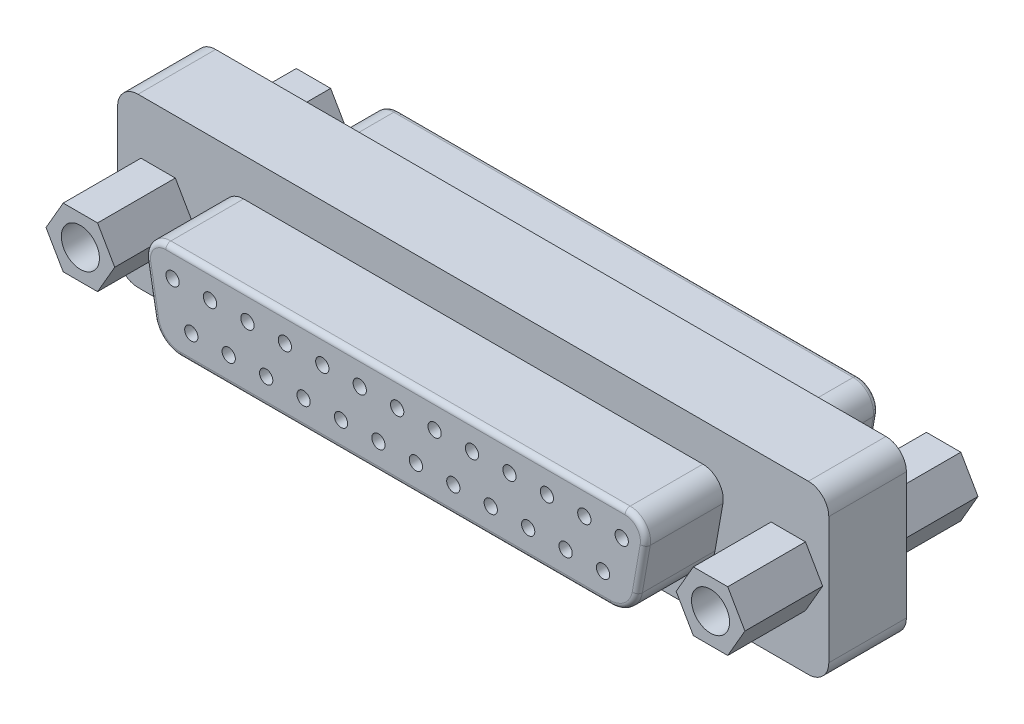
SolidWorks part; units mm, degrees
ref_plane "Plane1" through (0, 0, 0) normal (0, 0, 1) x (1, 0, 0)
ref_plane "Plane2" through (0, 0, 0) normal (0, 1, 0) x (1, 0, 0)
ref_plane "Plane3" through (0, 0, 0) normal (1, 0, 0) x (0, 0, -1)
sketch "Sketch1" plane through (0, 0, 0) normal (0, 0, 1) x (1, 0, 0)
  line L0 (25.019, 4.7244) -> (-25.019, -4.7244) construction
  line L1 (-25.019, 6.2484) -> (25.019, 6.2484)
  line L2 (-26.543, 4.7244) -> (-26.543, -4.7244)
  line L3 (-25.019, -6.2484) -> (25.019, -6.2484)
  line L4 (26.543, 4.7244) -> (26.543, -4.7244)
  line L5 (0, 0) -> (0, 7.4679) construction
  arc A0 (25.019, 6.2484) -> (26.543, 4.7244) centre (25.019, 4.7244) cw
  arc A1 (25.019, -6.2484) -> (26.543, -4.7244) centre (25.019, -4.7244) ccw
  arc A2 (-26.543, -4.7244) -> (-25.019, -6.2484) centre (-25.019, -4.7244) ccw
  arc A3 (-25.019, 6.2484) -> (-26.543, 4.7244) centre (-25.019, 4.7244) ccw
  circle A4 centre (-23.5204, 0) radius 1.524 construction
  circle A5 centre (23.5204, 0) radius 1.524 construction
  point P9 (26.543, -6.2484)
  point P15 (-26.543, 6.2484)
  dimension "D1" = 1.524
  dimension "mounting_holes_diameter" = 3.048
  dimension "flange_length" = 53.086
  dimension "flange_width" = 12.4968
  dimension "mounting_hole_pitch" = 47.0408
extrude "Flange Base-Extrude" add sketch "Sketch1" along normal mid plane 5.7912
sketch "Sketch2" plane through (0, 0, 0) normal (0, 0, 1) x (1, 0, 0)
  line L0 (-18.6436, 1.6277) -> (-18.0503, -1.7372)
  line L1 (18.6436, 1.6277) -> (18.0503, -1.7372)
  line L2 (16.0492, -3.4163) -> (-16.0492, -3.4163)
  line L3 (-17.1428, 3.4163) -> (17.1428, 3.4163)
  line L4 (0, 0) -> (0, 5.2616) construction
  line L5 (0, 0) -> (3.5249, 0) construction
  arc A0 (18.6436, 1.6277) -> (17.1428, 3.4163) centre (17.1428, 1.8923) ccw
  arc A1 (-18.6436, 1.6277) -> (-17.1428, 3.4163) centre (-17.1428, 1.8923) cw
  arc A2 (18.0503, -1.7372) -> (16.0492, -3.4163) centre (16.0492, -1.3843) cw
  arc A3 (-18.0503, -1.7372) -> (-16.0492, -3.4163) centre (-16.0492, -1.3843) ccw
  dimension "D2" = 1.524
  dimension "D3" = 2.032
  dimension "D1" = 20
  dimension "guard_width" = 6.8326
  dimension "guard_length" = 37.2872
extrude "Extrude3" add sketch "Sketch2" along normal blind 8.6995
sketch "Sketch5" plane through (0, 0, 2.8956) normal (0, 0, 1) x (1, 0, 0)
  line L0 (0, 0) -> (0, 25.4) construction
  line L1 (-26.0867, 0) -> (-24.8036, -2.2225)
  line L2 (-24.8036, -2.2225) -> (-22.2372, -2.2225)
  line L3 (-22.2372, -2.2225) -> (-20.9541, 0)
  line L4 (-20.9541, 0) -> (-22.2372, 2.2225)
  line L5 (-22.2372, 2.2225) -> (-24.8036, 2.2225)
  line L6 (-24.8036, 2.2225) -> (-26.0867, 0)
  line L7 (24.8036, 2.2225) -> (26.0867, 0)
  line L8 (22.2372, 2.2225) -> (24.8036, 2.2225)
  line L9 (20.9541, 0) -> (22.2372, 2.2225)
  line L10 (22.2372, -2.2225) -> (20.9541, 0)
  line L11 (24.8036, -2.2225) -> (22.2372, -2.2225)
  line L12 (26.0867, 0) -> (24.8036, -2.2225)
  circle A0 centre (-23.5204, 0) radius 2.2225 construction
  circle A1 centre (-23.5204, 0) radius 1.524 construction
  circle A2 centre (23.5204, 0) radius 2.2225 construction
  dimension "D1" = 4.445
extrude "Extrude4" add sketch "Sketch5" along normal up to surface (5.8039 mm away)
hole_wizard "#4-40 Tapped Hole1" positions "Sketch7" profile "Sketch6" tap size "#4-40" standard "STS Hardware Standard"
sketch "Sketch7" plane through (0, 0, 8.6995) normal (0, 0, 1) x (1, 0, 0)
  point P0 (-23.5204, 0)
  point P2 (23.5204, 0)
sketch "Sketch6" plane through (-23.5204, 0, 8.6995) normal (1, 0, 0) x (0, -1, 0)
  line L0 (0, 0) -> (0, 8.2738)
  line L1 (0, 8.2738) -> (1.1303, 7.5946)
  line L2 (1.1303, 7.5946) -> (1.1303, 5.6896)
  line L3 (1.1303, 5.6896) -> (1.4224, 5.6896)
  line L4 (1.4224, 5.6896) -> (1.4224, 0)
  line L5 (1.4224, 0) -> (0, 0)
  line L10 (0, 8.2738) -> (-1.1303, 7.5946) construction
  line L11 (0, -6.35) -> (0, 107.95) construction
  dimension "Tap Drill Dia." = 2.2606
  dimension "Tap Drill Depth" = 7.5946
  dimension "Thread Major Dia." = 2.8448
  dimension "Thread Depth" = 5.6896
  dimension "Drill Angle" = 118
mirror "Mirror3" about plane through (0, 0, 0) normal (0, 0, 1) of "Extrude4", "Extrude3"
hole_wizard "#4-40 Tapped Hole2" positions "Sketch9" profile "Sketch8" tap size "#4-40" standard "STS Hardware Standard"
sketch "Sketch9" plane through (0, 0, -8.6995) normal (0, 0, -1) x (-1, 0, 0)
  point P0 (-23.5204, 0)
  point P1 (23.5204, 0)
sketch "Sketch8" plane through (23.5204, 0, -8.6995) normal (1, 0, 0) x (0, 1, 0)
  line L0 (0, 0) -> (0, 8.2738)
  line L1 (0, 8.2738) -> (1.1303, 7.5946)
  line L2 (1.1303, 7.5946) -> (1.1303, 5.6896)
  line L3 (1.1303, 5.6896) -> (1.4224, 5.6896)
  line L4 (1.4224, 5.6896) -> (1.4224, 0)
  line L5 (1.4224, 0) -> (0, 0)
  line L10 (0, 8.2738) -> (-1.1303, 7.5946) construction
  line L11 (0, -6.35) -> (0, 107.95) construction
  dimension "Tap Drill Dia." = 2.2606
  dimension "Tap Drill Depth" = 7.5946
  dimension "Thread Major Dia." = 2.8448
  dimension "Thread Depth" = 5.6896
  dimension "Drill Angle" = 118
sketch "Sketch3" plane through (0, 0, 8.6995) normal (0, 0, 1) x (1, 0, 0)
  circle A0 centre (-16.637, 1.4224) radius 0.4953
  dimension "D3" = 0.9906
  dimension "Location Of 1st Pin" = 16.637
  dimension "D2" = 1.4224
extrude "Cut-Extrude1" cut sketch "Sketch3" against normal up to surface (17.399 mm away)
pattern_linear "LPattern1" count 13 spacing 2.794 along (1, 0, 0) of "Cut-Extrude1"
sketch "Sketch4" plane through (0, 0, 8.6995) normal (0, 0, 1) x (1, 0, 0)
  circle A0 centre (-15.24, -1.4224) radius 0.4953
  circle A3 centre (-16.637, 1.4224) radius 0.4953 construction
  dimension "D1" = 1.397
  dimension "D2" = 2.8448
extrude "Cut-Extrude2" cut sketch "Sketch4" against normal up to surface (17.399 mm away)
pattern_linear "LPattern2" count 12 spacing 2.794 along (1, 0, 0) of "Cut-Extrude2"
fillet "Fillet1" radius 0.381 16 edges at (18.3102, 2.8719, -8.6995) (0, 3.4163, -8.6995) (-18.3102, 2.8719, -8.6995) (-18.3469, -0.0547, -8.6995) (-17.3553, -2.9409, -8.6995) (0, -3.4163, -8.6995) (17.3553, -2.9409, -8.6995) (18.3469, -0.0547, -8.6995) (18.3102, 2.8719, 8.6995) (0, 3.4163, 8.6995) (-18.3102, 2.8719, 8.6995) (-18.3469, -0.0547, 8.6995) (-17.3553, -2.9409, 8.6995) (0, -3.4163, 8.6995) (17.3553, -2.9409, 8.6995) (18.3469, -0.0547, 8.6995)
